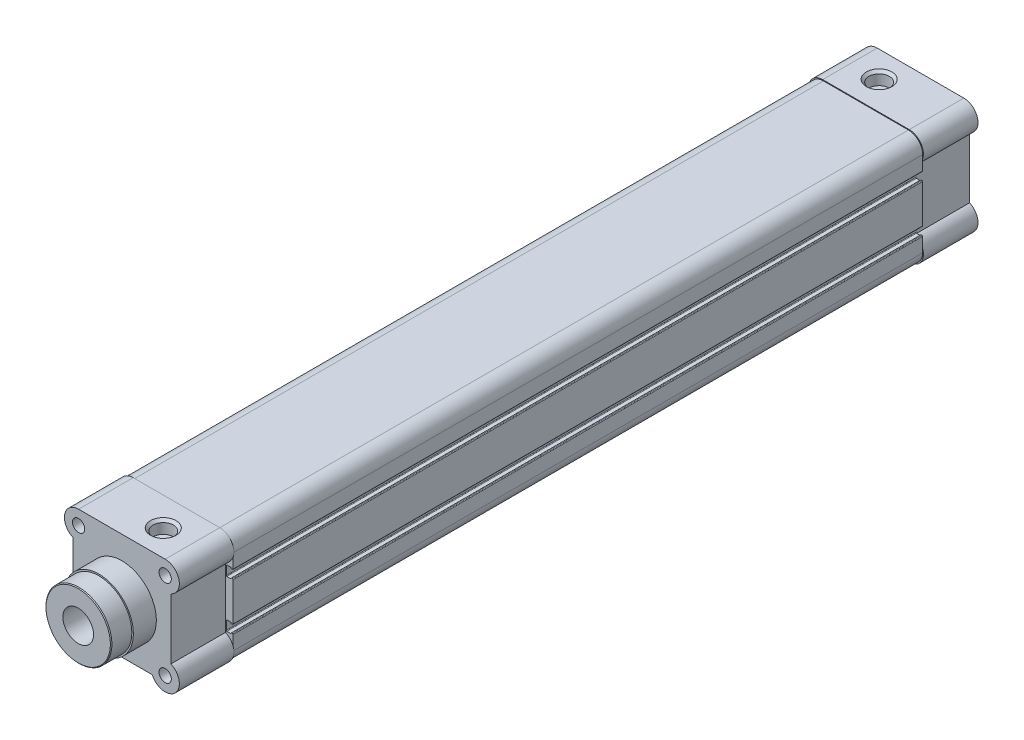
SolidWorks part; units mm, degrees
ref_plane "Plan de face" through (0, 0, 0) normal (0, 0, 1) x (1, 0, 0)
ref_plane "Plan de dessus" through (0, 0, 0) normal (0, 1, 0) x (1, 0, 0)
ref_plane "Plan de droite" through (0, 0, 0) normal (1, 0, 0) x (0, 0, -1)
imported_body "Importée1"
hole_wizard "Trou taraudé M8x1.251" positions "Esquisse2" profile "Esquisse1" tap size "M8x1.25" standard "ISO"
sketch "Esquisse2" plane through (0, 0, 0) normal (0, 0, 1) x (1, 0, 0)
  point P1 (-28.25, 28.25)
  point P2 (28.25, -28.25)
  point P3 (-28.25, -28.25)
  point P5 (28.25, 28.25)
sketch "Esquisse1" plane through (-28.25, 28.25, 0) normal (1, 0, 0) x (0, -1, 0)
  line L0 (0, 0) -> (0, 22.7929)
  line L1 (0, 22.7929) -> (3.4, 20.75)
  line L2 (3.4, 20.75) -> (3.4, 0)
  line L5 (3.4, 0) -> (0, 0)
  line L10 (0, 22.7929) -> (-3.4, 20.75) construction
  line L11 (0, -6.35) -> (0, 107.95) construction
  dimension "Diamètre du trou pour taraudage" = 6.8
  dimension "Profondeur du trou pour taraudage" = 20.75
  dimension "Angle de pointe" = 118
hole_wizard "Trou taraudé M8x1.252" positions "Esquisse4" profile "Esquisse3" tap size "M8x1.25" standard "ISO"
sketch "Esquisse4" plane through (0, 0, -521) normal (0, 0, -1) x (-1, 0, 0)
  point P1 (-28.25, 28.25)
  point P2 (28.25, 28.25)
  point P4 (28.25, -28.25)
  point P6 (-28.25, -28.25)
sketch "Esquisse3" plane through (28.25, 28.25, -521) normal (1, 0, 0) x (0, 1, 0)
  line L0 (0, 0) -> (0, 22.7929)
  line L1 (0, 22.7929) -> (3.4, 20.75)
  line L2 (3.4, 20.75) -> (3.4, 0)
  line L5 (3.4, 0) -> (0, 0)
  line L10 (0, 22.7929) -> (-3.4, 20.75) construction
  line L11 (0, -6.35) -> (0, 107.95) construction
  dimension "Diamètre du trou pour taraudage" = 6.8
  dimension "Profondeur du trou pour taraudage" = 20.75
  dimension "Angle de pointe" = 118
